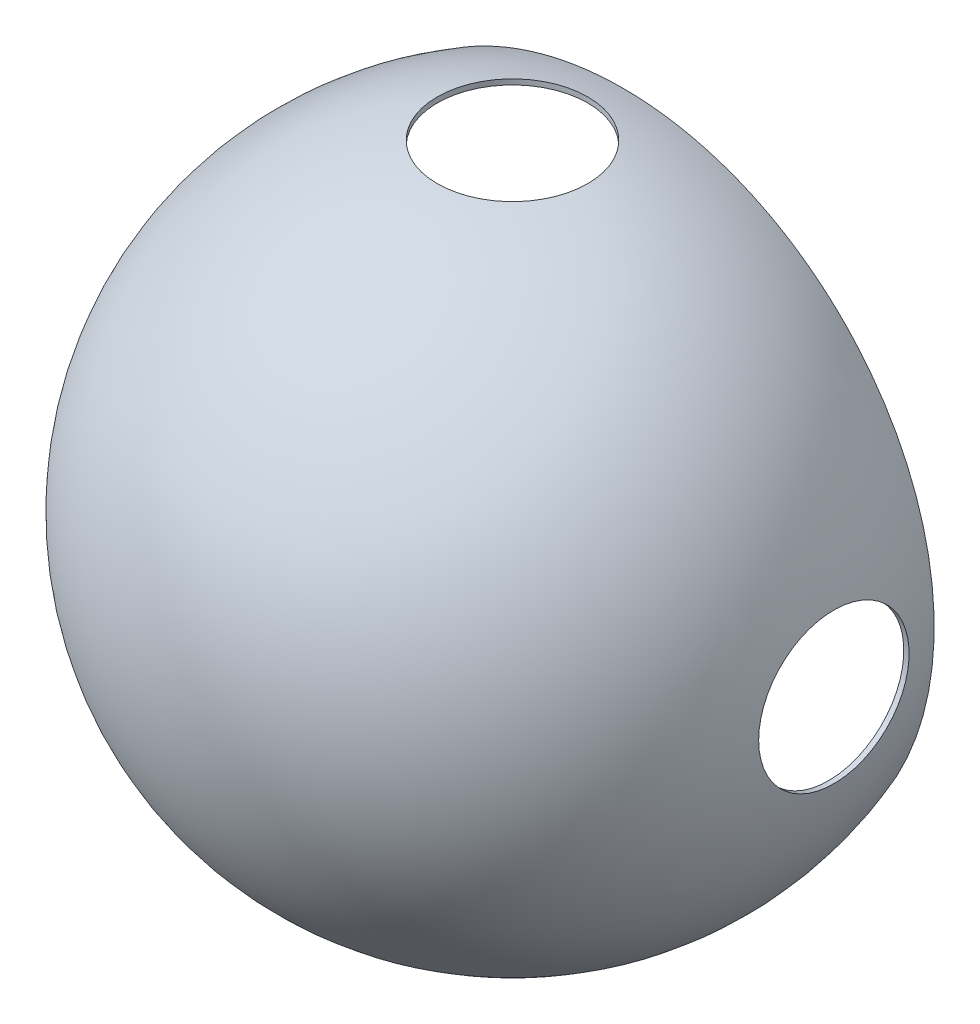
SolidWorks part; units mm, degrees
ref_plane "Front" through (0, 0, 0) normal (0, 0, 1) x (1, 0, 0)
ref_plane "Top" through (0, 0, 0) normal (0, 1, 0) x (1, 0, 0)
ref_plane "Right" through (0, 0, 0) normal (1, 0, 0) x (0, 0, -1)
sketch "Sketch1" plane through (0, 0, 0) normal (0, 0, 1) x (1, 0, 0)
  line L0 (0, 101.6) -> (0, 100.0125) construction
  line L1 (0, 101.6) -> (0, 100.0125)
  line L2 (0, -100.0125) -> (0, -101.6)
  line L3 (0, -100.0125) -> (0, -101.6) construction
  arc A0 (0, -100.0125) -> (0, 100.0125) centre (0, 0) ccw
  arc A1 (0, -101.6) -> (0, 101.6) centre (0, 0) ccw
  dimension "D1" = 1.5875
  dimension "D2" = 203.2
revolve "Revolve1" add sketch "Sketch1" angle 360 about L1
sketch "Sketch6" plane through (0, 0, 0) normal (0, 0, 1) x (1, 0, 0)
  line L0 (0, 0) -> (-70.7195, 70.7195) construction
  line L1 (0, 0) -> (-45.6015, 0) construction
  line L2 (0, 0) -> (17.2244, 17.2244) construction
  circle A0 centre (0, 0) radius 100.0125
  arc A1 (-68.4391, 72.9287) -> (-72.9287, 68.4391) centre (0, 0) ccw
  arc A2 (-72.9287, 68.4391) -> (-68.4391, 72.9287) centre (-70.7195, 70.7195) ccw
  dimension "D1" = 6.35
  dimension "D2" = 45
revolve "Revolve2" add sketch "Sketch6" angle 360 about L2
sketch "Sketch3" plane through (0, 0, 0) normal (1, 0, 0) x (0, 0, -1)
  line L0 (34.0959, 94.0211) -> (34.0959, 97.5034) construction
  line L4 (34.0959, 98.4285) -> (34.0959, -98.7852)
extrude "Cut-Extrude1" cut sketch "Sketch3" against normal through all and the other way through all
sketch "Sketch4" plane through (0, 0, 0) normal (1, 0, 0) x (0, 0, -1)
  circle A0 centre (0, 0) radius 23.1521
  dimension "D1" = 46.3042
extrude "Cut-Extrude2" cut sketch "Sketch4" against normal mid plane 215.9
sketch "Sketch5" plane through (0, 0, 0) normal (0, 1, 0) x (1, 0, 0)
  circle A0 centre (0, 0) radius 23.1521
  dimension "D1" = 46.3042
extrude "Cut-Extrude3" cut sketch "Sketch5" against normal mid plane 215.9
sketch "Sketch7" plane through (0, 0, 0) normal (1, 0, 0) x (0, 0, -1)
  line L0 (34.0959, -95.708) -> (34.0959, 95.708) construction
  line L1 (30.9209, -95.1126) -> (30.9209, -87.6901)
  line L2 (30.9209, -87.6901) -> (34.0959, -87.6901)
  line L3 (0, 0) -> (28.1738, 0) construction
  line L4 (34.0959, -94.0211) -> (34.0959, -87.6901)
  arc A0 (-23.1521, 97.2958) -> (-99.9117, 4.4896) centre (0, 0) ccw
  arc A1 (30.9209, -95.1126) -> (34.0959, -94.0211) centre (0, 0) ccw
  arc A2 (-99.9117, -4.4896) -> (-22.225, -97.5118) centre (0, 0) ccw
  dimension "D1" = 3.175
revolve "Cut-Revolve1" cut sketch "Sketch7" angle 360 about L3
